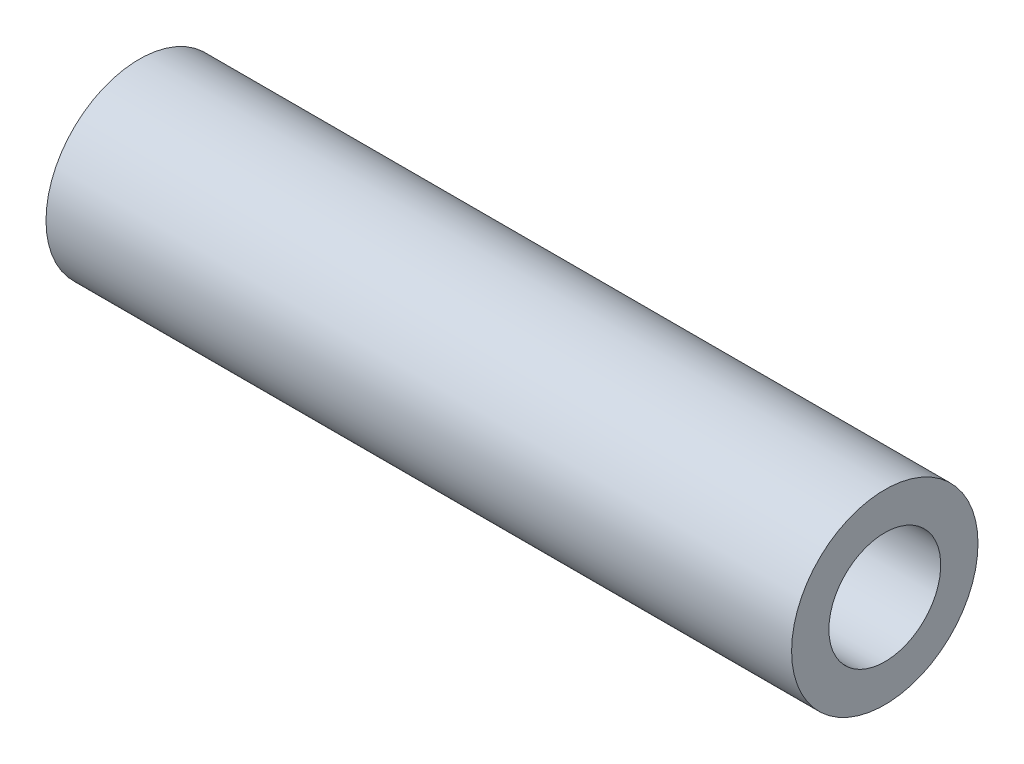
SolidWorks part; units mm, degrees
ref_plane "Front Plane" through (0, 0, 0) normal (0, 0, 1) x (1, 0, 0)
ref_plane "Top Plane" through (0, 0, 0) normal (0, 1, 0) x (1, 0, 0)
ref_plane "Right Plane" through (0, 0, 0) normal (1, 0, 0) x (0, 0, -1)
sketch "Sketch1" plane through (0, 0, 0) normal (0, 0, 1) x (1, 0, 0)
  line L0 (0, 0) -> (100, 0)
  line L1 (100, 0) -> (100, 5)
  line L2 (100, 5) -> (0, 5)
  line L3 (0, 5) -> (0, 0)
  line L4 (0, -7.5) -> (113.551, -7.5) construction
  dimension "D1" = 5
  dimension "D2" = 100
  dimension "D3" = 15
revolve "Revolve1" add sketch "Sketch1" angle 360 about L4
